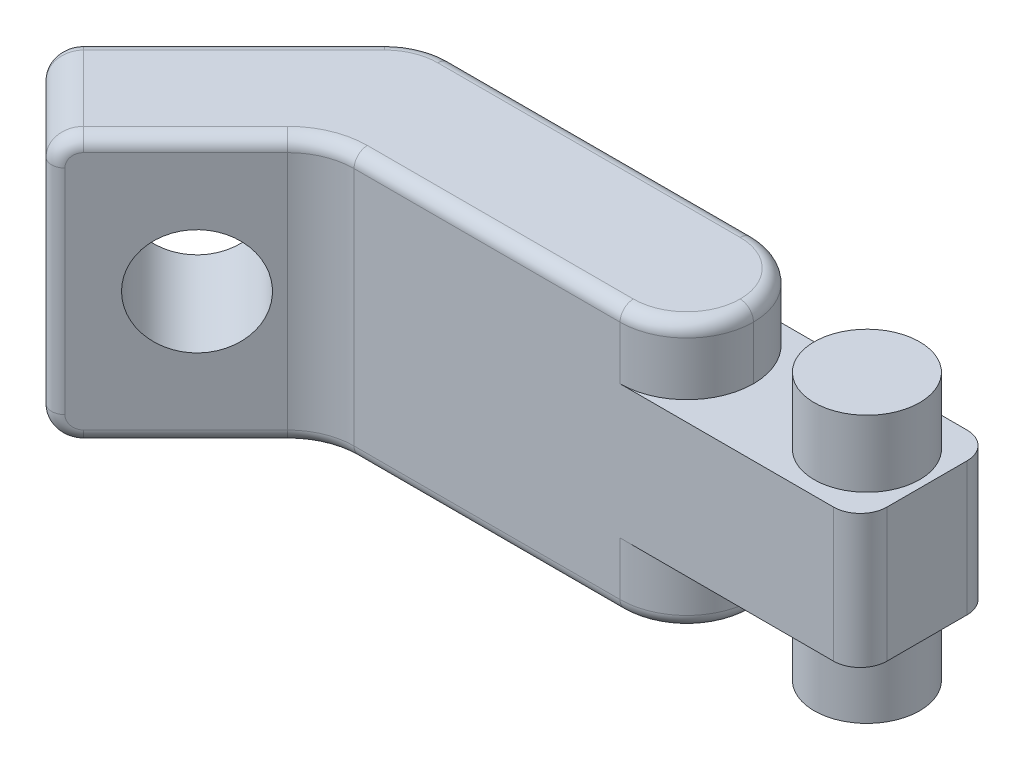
SolidWorks part; units mm, degrees
ref_plane "Piano frontale" through (0, 0, 0) normal (0, 0, 1) x (1, 0, 0)
ref_plane "Piano superiore" through (0, 0, 0) normal (0, 1, 0) x (1, 0, 0)
ref_plane "Piano destro" through (0, 0, 0) normal (1, 0, 0) x (0, 0, -1)
sketch "Schizzo1" plane through (0, 0, 0) normal (0, 0, 1) x (1, 0, 0)
  line L6 (0, 0) -> (-63.6396, -63.6396)
  line L7 (-63.6396, -63.6396) -> (77.7817, -205.061)
  line L8 (77.7817, -205.061) -> (505.061, -205.061)
  line L9 (505.061, -205.061) -> (505.061, -105.061)
  line L10 (505.061, -105.061) -> (105.061, -105.061)
  line L11 (105.061, -105.061) -> (0, 0)
  dimension "D1" = 400
  dimension "D2" = 100
  dimension "D3" = 90
  dimension "D4" = 200
  dimension "D5" = 135
  dimension "D6" = 135
  dimension "D7" = 90
extrude "Estrusione-Estrusione1" add sketch "Schizzo1" along normal blind 200
sketch "Schizzo3" plane through (0, 0, 0) normal (0.7071, 0.7071, 0) x (0.7071, -0.7071, 0)
  line L0 (0, -100) -> (148.5786, -100) construction
  line L1 (0, -200) -> (0, 0) construction
  line L2 (148.5786, -200) -> (148.5786, 0) construction
  line L3 (80, 0) -> (80, -200) construction
  line L4 (148.5786, 0) -> (0, 0) construction
  line L5 (148.5786, -200) -> (0, -200) construction
  circle A0 centre (80, -100) radius 40
  dimension "D1" = 80
  dimension "D2" = 80
extrude "Taglio-Estrusione3" cut sketch "Schizzo3" against normal through all
fillet "Raccordo6" radius 20 1 edges at (-31.8198, -31.8198, 200)
fillet "Raccordo7" radius 20 1 edges at (-31.8198, -31.8198, 0)
fillet "Raccordo8" radius 50 1 edges at (105.061, -105.061, 100)
fillet "Raccordo9" radius 50 1 edges at (77.7817, -205.061, 100)
ref_plane "Piano simmetria" through (0, 0, 100) normal (0, 0, -1) x (-1, 0, 0)
sketch "Schizzo7" plane through (0, 0, 200) normal (0, 0, 1) x (1, 0, 0)
  line L0 (505.061, -155.061) -> (136.7641, -155.061) construction
  line L1 (505.061, -205.061) -> (505.061, -105.061) construction
  line L2 (450.061, -105.061) -> (450.061, -205.061) construction
  line L3 (505.061, -105.061) -> (125.7716, -105.061) construction
  line L4 (98.4924, -205.061) -> (505.061, -205.061) construction
  circle A0 centre (450.061, -155.061) radius 75
  dimension "D1" = 150
  dimension "D2" = 55
extrude "Taglio-Estrusione5" cut sketch "Schizzo7" against normal blind 50
sketch "Schizzo8" plane through (0, 0, 0) normal (0, 0, 1) x (1, 0, 0)
  line L0 (505.061, -155.061) -> (375.061, -155.061) construction
  line L1 (505.061, -205.061) -> (505.061, -105.061) construction
  line L2 (460.061, -105.061) -> (460.061, -205.061) construction
  line L3 (505.061, -105.061) -> (394.1593, -105.061) construction
  line L4 (394.1593, -205.061) -> (505.061, -205.061) construction
  line L5 (505.061, -205.061) -> (505.061, -105.061) construction
  line L6 (505.061, -105.061) -> (125.7716, -105.061) construction
  arc A0 (394.1593, -105.061) -> (394.1593, -205.061) centre (450.061, -155.061) ccw construction
  circle A1 centre (460.061, -155.061) radius 39.5
  dimension "D1" = 79
  dimension "D2" = 45
  dimension "D3" = 50
extrude "Estrusione-Estrusione3" add sketch "Schizzo8" along normal blind 200
fillet "Raccordo11" radius 50 1 edges at (394.1593, -105.061, 175)
fillet "Raccordo12" radius 50 1 edges at (394.1593, -205.061, 175)
fillet "Raccordo14" radius 20 1 edges at (505.061, -205.061, 75)
mirror "Specchia2" about plane through (0, 0, 100) normal (0, 0, -1) of "Taglio-Estrusione5", "Raccordo12", "Raccordo11", "Estrusione-Estrusione3"
move or copy body "Corpo-Sposta/copia1" bodies to move or copy 128 copy no rotation origin (0, -88.9711, 100) rotation axis (1, 0, 0) rotation angle 90
fillet "Raccordo15" radius 20 1 edges at (505.061, -88.9711, 83.9102)
fillet "Raccordo16" radius 10 22 edges at (-59.4975, -183.1133, 121.1894) (-63.6396, -88.9711, 125.3315) (-59.4975, 5.171, 121.1894) (6.8198, 11.0289, 54.8721) (79.3583, 11.0289, -12.2838) (211.7767, 11.0289, -16.0898) (360.4163, 11.0289, -1.4452) (360.4163, 11.0289, 69.2655) (225.4163, 11.0289, 83.9102) (106.6375, 11.0289, 87.7162) (52.2792, 11.0289, 136.6919) (4.1421, 5.171, 184.829) (0, -88.9711, 188.9711) (4.1421, -183.1133, 184.829) (79.3583, -188.9711, -12.2838) (6.8198, -188.9711, 54.8721) (52.2792, -188.9711, 136.6919) (106.6375, -188.9711, 87.7162) (225.4163, -188.9711, 83.9102) (360.4163, -188.9711, 69.2655) (360.4163, -188.9711, -1.4452) (211.7767, -188.9711, -16.0898)
